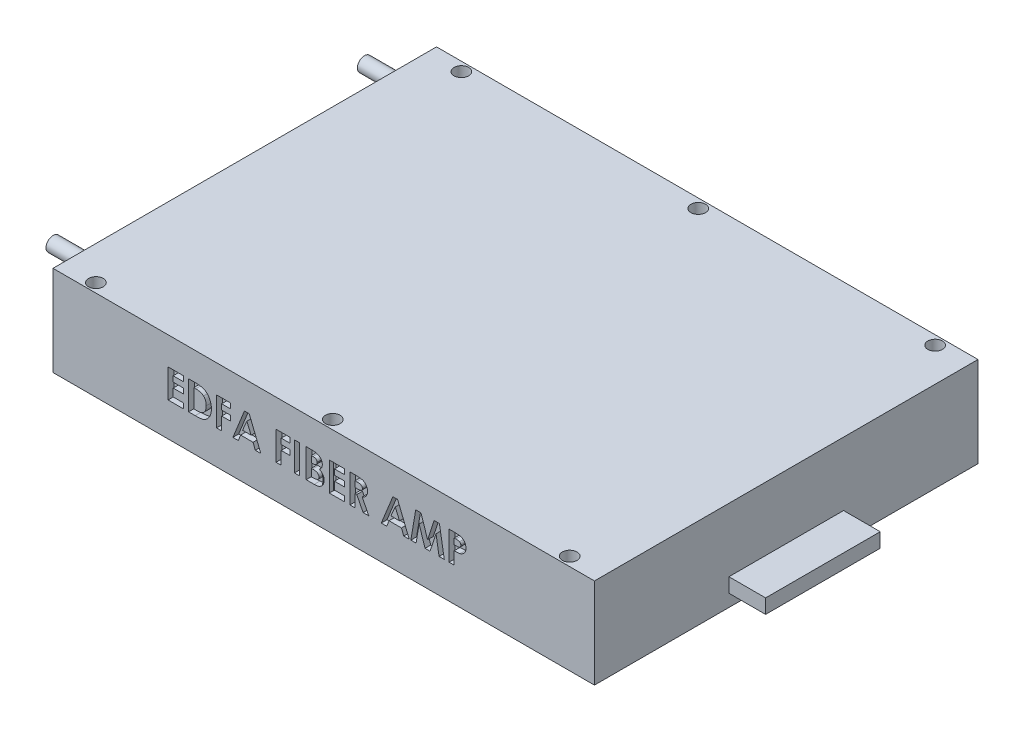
SolidWorks part; units mm, degrees
ref_plane "Front Plane" through (0, 0, 0) normal (0, 0, 1) x (1, 0, 0)
ref_plane "Top Plane" through (0, 0, 0) normal (0, 1, 0) x (1, 0, 0)
ref_plane "Right Plane" through (0, 0, 0) normal (1, 0, 0) x (0, 0, -1)
sketch "Sketch1" plane through (0, 0, 0) normal (0, 1, 0) x (1, 0, 0)
  line L1 (0, 0) -> (240.0046, 0)
  line L2 (0, 0) -> (0, 170.0022)
  line L3 (0, 170.0022) -> (240.0046, 170.0022)
  line L4 (240.0046, 0) -> (240.0046, 170.0022)
  dimension "D1" = 240.0046
  dimension "D2" = 170.0022
extrude "Boss-Extrude1" add sketch "Sketch1" along normal blind 40.005
sketch "Sketch2" plane through (240.0046, 0, 0) normal (1, 0, 0) x (0, 0, -1)
  line L0 (0, 0) -> (170.0022, 0) construction
  line L1 (59.6138, 11.811) -> (110.4138, 11.811)
  line L2 (59.6138, 11.811) -> (59.6138, 5.461)
  line L3 (59.6138, 5.461) -> (110.4138, 5.461)
  line L4 (110.4138, 11.811) -> (110.4138, 5.461)
  line L5 (0, 40.005) -> (0, 0) construction
  dimension "D1" = 50.8
  dimension "D2" = 6.35
  dimension "D3" = 5.461
  dimension "D4" = 59.6138
extrude "Boss-Extrude2" add sketch "Sketch2" along normal blind 50.8
sketch "Sketch3" plane through (0, 0, 0) normal (-1, 0, 0) x (0, 0, 1)
  line L0 (-170.0022, 40.005) -> (-170.0022, 0) construction
  line L1 (-170.0022, 0) -> (0, 0) construction
  circle A0 centre (-154.0002, 33.5026) radius 3.175
  circle A1 centre (-16.002, 33.5026) radius 3.175
  dimension "D1" = 6.35
  dimension "D2" = 6.35
  dimension "D3" = 16.002
  dimension "D4" = 154.0002
  dimension "D5" = 33.5026
  dimension "D6" = 33.5026
extrude "Boss-Extrude3" add sketch "Sketch3" along normal blind 50.8
sketch "Sketch5" plane through (0, 0, 0) normal (0, 0, 1) x (1, 0, 0)
  text T0 "EDFA FIBER AMP" font "Century Gothic" height in points 48
sketch "Sketch6" plane through (0, 0, -170.0022) normal (0, 0, -1) x (-1, 0, 0)
  text T0 "EDFA FIBER AMP" font "Century Gothic" height in points 48
hole_wizard "CBORE for M3 SHCS1" positions "Sketch8" profile "Sketch7" counterbore size "M3" standard "ANSI Metric"
sketch "Sketch8" plane through (0, 40.005, 0) normal (0, 1, 0) x (1, 0, 0)
  line L0 (0, 170.0022) -> (0, 0) construction
  line L1 (240.0046, 170.0022) -> (0, 170.0022) construction
  line L3 (0, 0) -> (240.0046, 0) construction
  point P0 (15.0114, 165.989)
  point P2 (120.015, 165.989)
  point P4 (225.0186, 165.989)
  point P6 (225.0186, 4.0132)
  point P8 (120.015, 4.0132)
  point P10 (15.0114, 4.0132)
  dimension "D1" = 15.0114
  dimension "D2" = 4.0132
  dimension "D3" = 105.0036
  dimension "D4" = 4.0132
  dimension "D5" = 4.0132
  dimension "D6" = 105.0036
  dimension "D7" = 15.0114
  dimension "D8" = 4.0132
  dimension "D9" = 4.0132
  dimension "D10" = 4.0132
  dimension "D11" = 105.0036
  dimension "D12" = 105.0036
sketch "Sketch7" plane through (15.0114, 40.005, -165.989) normal (1, 0, 0) x (0, 0, 1)
  line L0 (0, 0) -> (0, 40.005)
  line L1 (0, 40.005) -> (1.7, 40.005)
  line L3 (1.7, 40.005) -> (1.7, 37.29)
  line L4 (1.7, 37.29) -> (3.25, 37.29)
  line L5 (3.25, 37.29) -> (3.25, 0)
  line L7 (3.25, 0) -> (0, 0)
  line L11 (0, -6.35) -> (0, 107.95) construction
  dimension "Thru Hole Dia." = 3.4
  dimension "Thru Hole Depth" = 40.005
  dimension "C'Bore Dia." = 6.5
  dimension "C'Bore Depth" = 37.29
extrude "Cut-Extrude1" cut sketch "Sketch5" against normal blind 2.54
extrude "Cut-Extrude2" cut sketch "Sketch6" against normal blind 2.54
sketch "Sketch9" plane through (0, 40.005, 0) normal (0, 1, 0) x (1, 0, 0)
  line L1 (-15.9228, -19.2066) -> (-78.3036, -19.2066)
  line L2 (-15.9228, -19.2066) -> (-15.9228, 195.4999)
  line L3 (-15.9228, 195.4999) -> (-78.3036, 195.4999)
  line L4 (-78.3036, -19.2066) -> (-78.3036, 195.4999)
  line L5 (299.4545, 19.1578) -> (256.2506, 19.1578)
  line L6 (299.4545, 19.1578) -> (299.4545, 148.5107)
  line L7 (299.4545, 148.5107) -> (256.2506, 148.5107)
  line L8 (256.2506, 19.1578) -> (256.2506, 148.5107)
extrude "Cut-Extrude3" cut sketch "Sketch9" against normal through all and the other way through all
